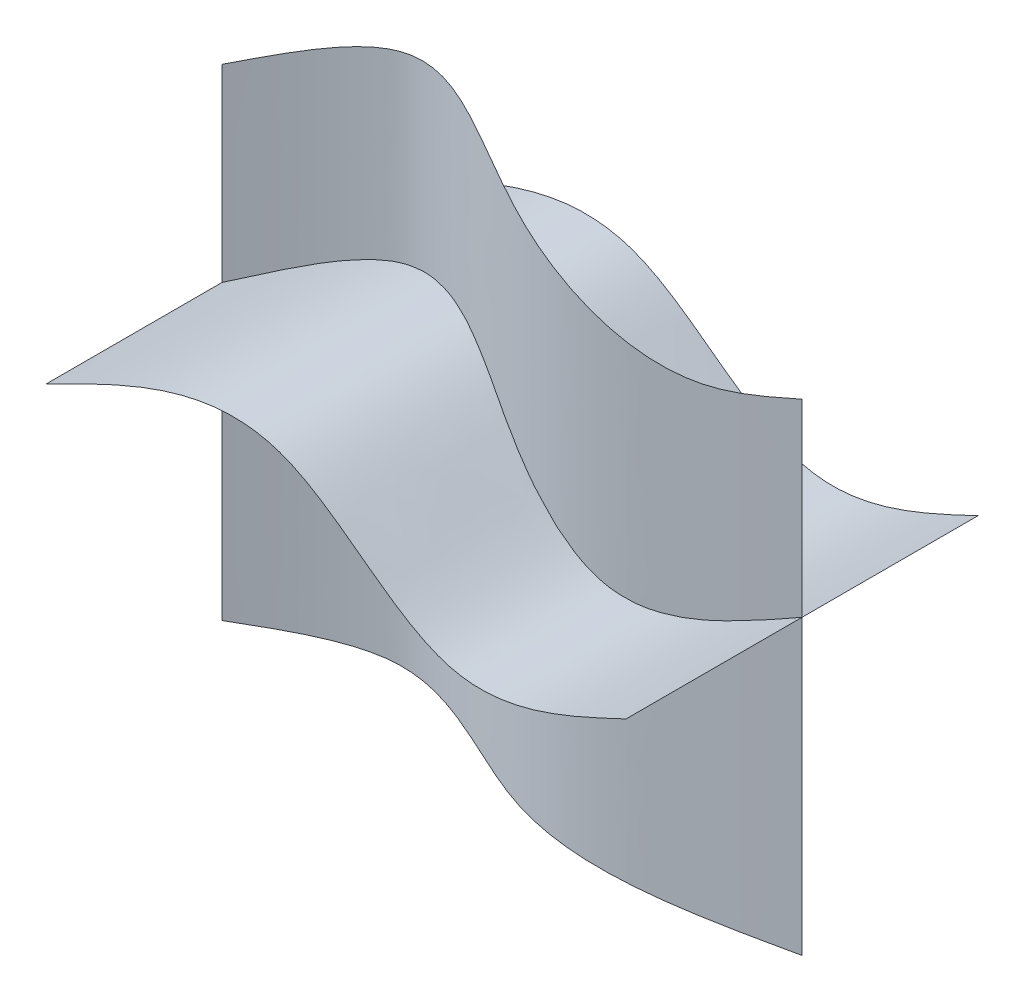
SolidWorks part; units mm, degrees
ref_plane "Front" through (0, 0, 0) normal (0, 0, 1) x (1, 0, 0)
ref_plane "Top" through (0, 0, 0) normal (0, 1, 0) x (1, 0, 0)
ref_plane "Right" through (0, 0, 0) normal (1, 0, 0) x (0, 0, -1)
sketch "Sketch1" plane through (0, 0, 0) normal (0, 0, 1) x (1, 0, 0)
  spline_without_curve S0
surface "Surface-Extrude1" sketch "Sketch1" parameters "D1"=101
sketch "Sketch2" plane through (0, 0, 0) normal (0, 1, 0) x (1, 0, 0)
  line L0 (-79.4813, -50.5) -> (-79.4813, 50.5) construction
  line L1 (86.9618, 50.5) -> (86.9618, -50.5) construction
  spline_without_curve S0
surface "Surface-Extrude2" sketch "Sketch2" parameters "D1"=168.0366
sketch "Sketch3" plane through (0, 0, 0) normal (0, 0, 1) x (1, 0, 0)
  line L0 (-79.4813, 84.0183) -> (-79.4813, -84.0183) construction
  spline_without_curve S0
surface "Surface-Trim9"
sketch "Sketch4" plane through (0, 0, 0) normal (0, 1, 0) x (1, 0, 0)
  line L1 (1.5801, -14.851) -> (95.9667, -14.851)
  line L2 (1.5801, -14.851) -> (1.5801, -54.2735)
  line L3 (1.5801, -54.2735) -> (95.9667, -54.2735)
  line L4 (95.9667, -14.851) -> (95.9667, -54.2735)
surface "Surface-Trim11"
surface "Surface-Untrim1"
